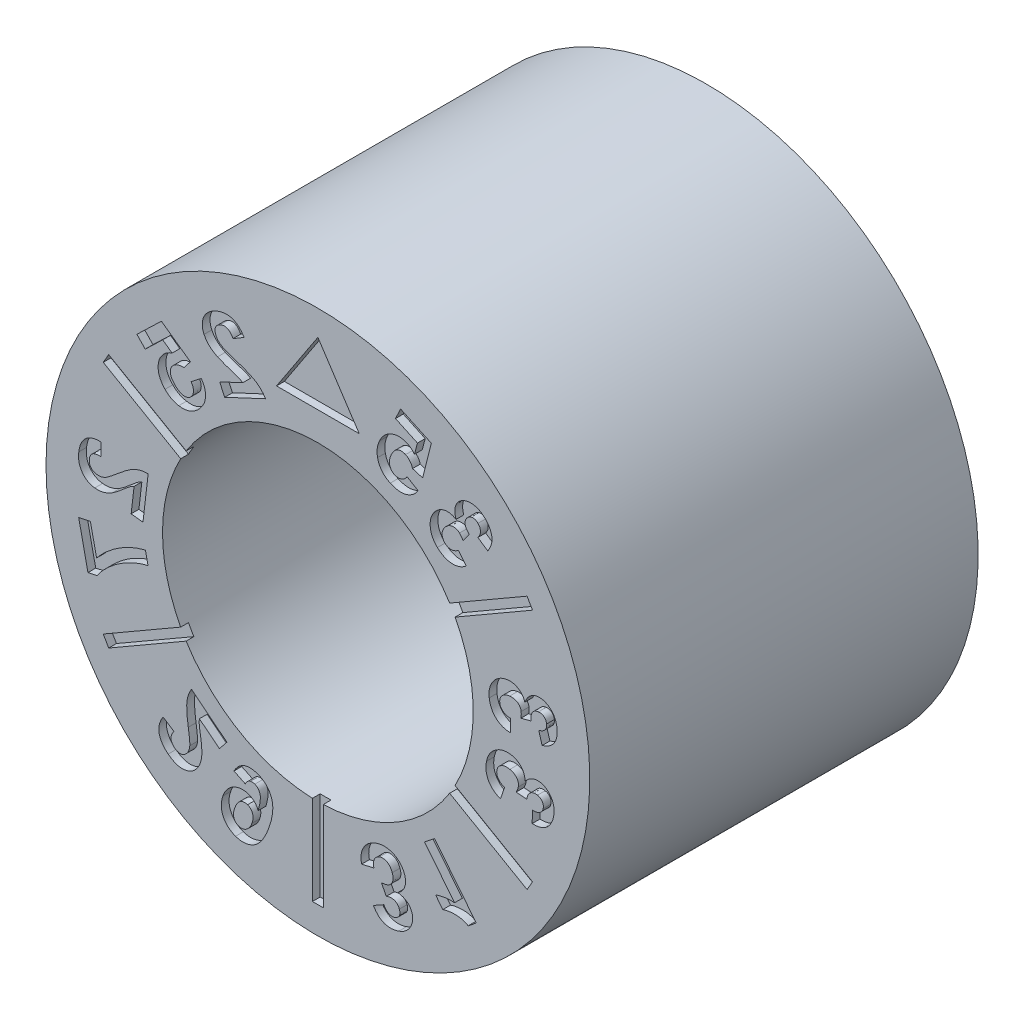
SolidWorks part; units mm, degrees
ref_plane "Front Plane" through (0, 0, 0) normal (0, 0, 1) x (1, 0, 0)
ref_plane "Top Plane" through (0, 0, 0) normal (0, 1, 0) x (1, 0, 0)
ref_plane "Right Plane" through (0, 0, 0) normal (1, 0, 0) x (0, 0, -1)
imported_body "Imported1"
other "Move Face1" parameters "D1"=0.22
other "DeleteFace2"
sketch "Sketch1" plane through (0, 0, 0) normal (0, 0, 1) x (1, 0, 0)
  line L0 (0, 0) -> (0, -3.9447) construction
  line L2 (-0.07, -1.65) -> (0.07, -1.65)
  line L3 (-0.07, -1.65) -> (-0.07, -3.15)
  line L4 (-0.07, -3.15) -> (0.07, -3.15)
  line L5 (0.07, -1.65) -> (0.07, -3.15)
  line L9 (0, 0) -> (-1.9723, -3.4162) construction
  line L10 (-1.4639, -0.7644) -> (-1.3939, -0.8856)
  line L11 (-1.3939, -0.8856) -> (-2.693, -1.6356)
  line L12 (-1.4639, -0.7644) -> (-2.763, -1.5144)
  line L13 (-2.763, -1.5144) -> (-2.693, -1.6356)
  line L14 (0, 0) -> (-3.4162, -1.9723) construction
  line L19 (0, 0) -> (-3.9447, 0) construction
  line L20 (-1.3939, 0.8856) -> (-1.4639, 0.7644)
  line L21 (-1.4639, 0.7644) -> (-2.763, 1.5144)
  line L22 (-1.3939, 0.8856) -> (-2.693, 1.6356)
  line L23 (-2.693, 1.6356) -> (-2.763, 1.5144)
  line L24 (0, 0) -> (-3.4162, 1.9723) construction
  line L29 (0, 0) -> (-1.9723, 3.4162) construction
  line L34 (0, 0) -> (0, 3.9447) construction
  line L39 (0, 0) -> (1.9723, 3.4162) construction
  line L40 (1.4639, 0.7644) -> (1.3939, 0.8856)
  line L41 (1.3939, 0.8856) -> (2.693, 1.6356)
  line L42 (1.4639, 0.7644) -> (2.763, 1.5144)
  line L43 (2.763, 1.5144) -> (2.693, 1.6356)
  line L44 (0, 0) -> (3.4162, 1.9723) construction
  line L49 (0, 0) -> (3.9447, 0) construction
  line L50 (1.3939, -0.8856) -> (1.4639, -0.7644)
  line L51 (1.4639, -0.7644) -> (2.763, -1.5144)
  line L52 (1.3939, -0.8856) -> (2.693, -1.6356)
  line L53 (2.693, -1.6356) -> (2.763, -1.5144)
  line L54 (0, 0) -> (3.4162, -1.9723) construction
  line L59 (0, 0) -> (1.9723, -3.4162) construction
  line L60 (0.07, 3.15) -> (-0.07, 3.15)
  line L61 (0.07, 1.65) -> (0.07, 3.15)
  line L62 (-0.07, 1.65) -> (-0.07, 3.15)
  line L63 (0.07, 1.65) -> (-0.07, 1.65)
  line L64 (-0.7644, 1.4639) -> (-1.5144, 2.763)
  line L65 (-1.5144, 2.763) -> (-1.6356, 2.693)
  line L66 (-0.8856, 1.3939) -> (-1.6356, 2.693)
  line L67 (-0.7644, 1.4639) -> (-0.8856, 1.3939)
  line L68 (0.8856, 1.3939) -> (1.6356, 2.693)
  line L69 (0.8856, 1.3939) -> (0.7644, 1.4639)
  line L70 (0.7644, 1.4639) -> (1.5144, 2.763)
  line L71 (-1.65, 0.07) -> (-3.15, 0.07)
  line L72 (-1.65, -0.07) -> (-3.15, -0.07)
  line L73 (-3.15, 0.07) -> (-3.15, -0.07)
  line L74 (-1.65, 0.07) -> (-1.65, -0.07)
  line L75 (1.65, 0.07) -> (3.15, 0.07)
  line L76 (3.15, -0.07) -> (3.15, 0.07)
  line L77 (1.65, -0.07) -> (3.15, -0.07)
  line L78 (1.65, -0.07) -> (1.65, 0.07)
  line L79 (-0.7644, -1.4639) -> (-1.5144, -2.763)
  line L80 (-0.8856, -1.3939) -> (-1.6356, -2.693)
  line L81 (-1.6356, -2.693) -> (-1.5144, -2.763)
  line L82 (-0.8856, -1.3939) -> (-0.7644, -1.4639)
  line L83 (0.8856, -1.3939) -> (1.6356, -2.693)
  line L84 (0.7644, -1.4639) -> (1.5144, -2.763)
  line L85 (0.7644, -1.4639) -> (0.8856, -1.3939)
  line L86 (1.5144, -2.763) -> (1.6356, -2.693)
  line L87 (1.6356, 2.693) -> (1.5144, 2.763)
  arc A0 (-0.6463, 2.1656) -> (0, 2.26) centre (0, 0) ccw construction
  text T0 "25  27  29  31  33  35" font "Arial" height 0.87
  point P66 (0, 0)
  dimension "D1" = 4.52
  dimension "D6" = 12
extrude "Cut-Extrude1" cut sketch "Sketch1" against normal blind 0.1
